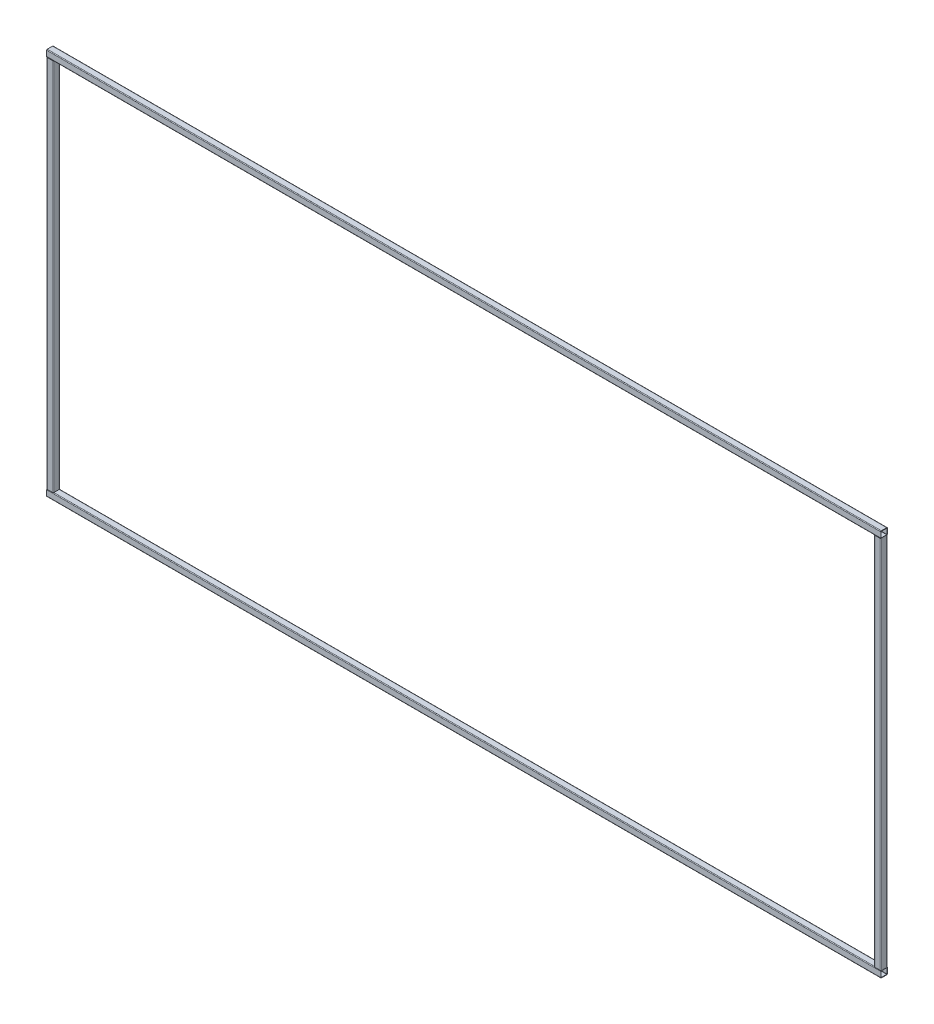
SolidWorks part; units mm, degrees
ref_plane "Ebene vorne" through (0, 0, 0) normal (0, 0, 1) x (1, 0, 0)
ref_plane "Ebene oben" through (0, 0, 0) normal (0, 1, 0) x (1, 0, 0)
ref_plane "Ebene rechts" through (0, 0, 0) normal (1, 0, 0) x (0, 0, -1)
sketch "Skizze2" plane through (0, 0, 0) normal (0, 0, 1) x (1, 0, 0)
  line L1 (-2500, -1150) -> (2500, -1150)
  line L2 (-2500, -1150) -> (-2500, 1150)
  line L3 (-2500, 1150) -> (2500, 1150)
  line L4 (2500, -1150) -> (2500, 1150)
  line L5 (-2500, -1150) -> (2500, 1150) construction
  line L6 (-2500, 1150) -> (2500, -1150) construction
  point P0 (0, 0)
  dimension "D1" = 5000
  dimension "D2" = 2300
other "Strukturbauteil1"
ref_plane "Ebene1" through (-2500, 1150, 0) normal (1, 0, 0) x (0, 1, 0)
sketch "Skizze1" plane through (-2500, 1150, 0) normal (1, 0, 0) x (0, 1, 0)
  line L0 (17, -16) -> (17, 16)
  line L1 (16, -20) -> (-16, -20)
  line L2 (20, -16) -> (20, 16)
  line L3 (16, 20) -> (-16, 20)
  line L4 (-20, -16) -> (-20, 16)
  line L5 (16, 17) -> (-16, 17)
  line L6 (-17, -16) -> (-17, 16)
  line L7 (16, -17) -> (-16, -17)
  line L8 (0, -20) -> (0, 20) construction
  arc A0 (-20, 16) -> (-16, 20) centre (-16, 16) cw
  arc A1 (-16, -20) -> (-20, -16) centre (-16, -16) cw
  arc A2 (20, -16) -> (16, -20) centre (16, -16) cw
  arc A3 (16, 20) -> (20, 16) centre (16, 16) cw
  arc A4 (16, 17) -> (17, 16) centre (16, 16) cw
  arc A5 (-17, 16) -> (-16, 17) centre (-16, 16) cw
  arc A6 (-16, -17) -> (-17, -16) centre (-16, -16) cw
  arc A7 (17, -16) -> (16, -17) centre (16, -16) cw
  point P4 (0, 20)
  point P5 (0, -20)
  point P10 (-20, -20)
  point P13 (20, -20)
  point P16 (20, 20)
  point P25 (-20, -20)
  point P26 (-20, 20)
  point P27 (20, 20)
  point P30 (20, -20)
  point P31 (0, 0)
  point P32 (-20, 0)
  point P33 (20, 0)
  point P34 (0, 0)
  dimension "D3" = 4
  dimension "D1" = 40
  dimension "D2" = 40
  dimension "D4" = 3
